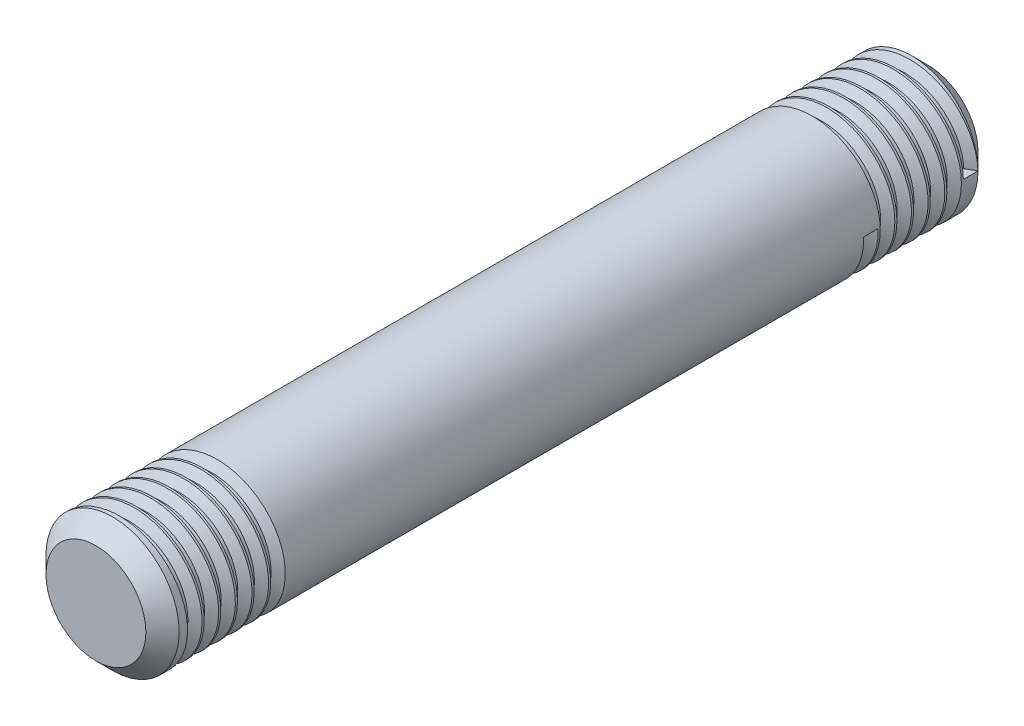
SolidWorks part; units mm, degrees
ref_plane "Front Plane" through (0, 0, 0) normal (0, 0, 1) x (1, 0, 0)
ref_plane "Top Plane" through (0, 0, 0) normal (0, 1, 0) x (1, 0, 0)
ref_plane "Right Plane" through (0, 0, 0) normal (1, 0, 0) x (0, 0, -1)
sketch "Sketch2" plane through (0, 0, 0) normal (0, 0, 1) x (1, 0, 0)
  circle A0 centre (0, 0) radius 4
  dimension "D1" = 8
extrude "Boss-Extrude1" add sketch "Sketch2" along normal blind 50
chamfer "Chamfer1" distance 1 2 edges at (4, 0, 50) (4, 0, 0)
thread "Thread1" pitch 1 start angle 0, offset 0, length 6, pitch 1, diameter 8
ref_plane "Plane1" through (-4, 0, 49) normal (0, -1, 0) x (-1, 0, 0)
sketch "Thread Profile1" plane through (-4, 0, 49) normal (0, -1, 0) x (-1, 0, 0)
  line L0 (0, 0) -> (0, 1) construction
  line L11 (0, 0) -> (0, 0.875)
  line L12 (0, 0.875) -> (-0.5413, 0.5625)
  line L13 (-0.5413, 0.5625) -> (-0.5413, 0.3125)
  line L15 (-0.5413, 0.3125) -> (0, 0)
  line L17 (-0.5413, 0.4375) -> (0, 0.4375) construction
  point P2 (0, 0)
  dimension "Pitch" = 1
  dimension "Profile_Angle" = 60
  dimension "Profile_Land" = 0.25
  dimension "Profile_Height" = 0.5413
thread "Thread2" pitch 1 start angle 0, offset 0, length 6, pitch 1, diameter 8
ref_plane "Plane3" through (4, 0, 1) normal (0, -1, 0) x (1, 0, 0)
sketch "Thread Profile2" plane through (4, 0, 1) normal (0, -1, 0) x (1, 0, 0)
  line L0 (0, 0) -> (0, 1) construction
  line L11 (0, 0) -> (0, 0.875)
  line L12 (0, 0.875) -> (-0.5413, 0.5625)
  line L13 (-0.5413, 0.5625) -> (-0.5413, 0.3125)
  line L15 (-0.5413, 0.3125) -> (0, 0)
  line L17 (-0.5413, 0.4375) -> (0, 0.4375) construction
  point P2 (0, 0)
  dimension "Pitch" = 1
  dimension "Profile_Angle" = 60
  dimension "Profile_Land" = 0.25
  dimension "Profile_Height" = 0.5413
